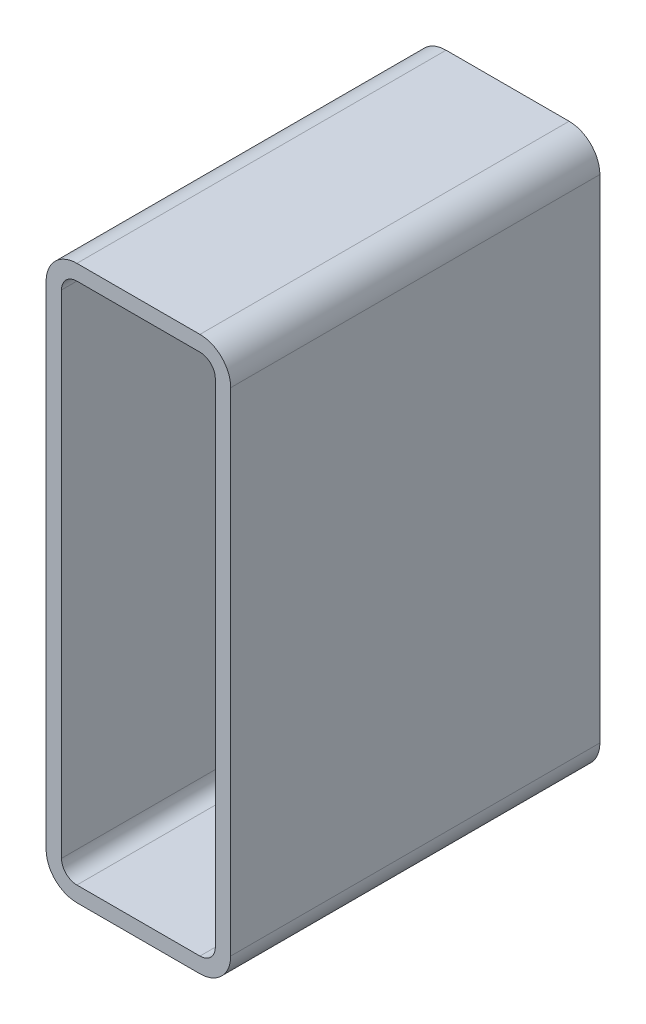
SolidWorks part; units mm, degrees
ref_plane "Front Plane" through (0, 0, 0) normal (0, 0, 1) x (1, 0, 0)
ref_plane "Top Plane" through (0, 0, 0) normal (0, 1, 0) x (1, 0, 0)
ref_plane "Right Plane" through (0, 0, 0) normal (1, 0, 0) x (0, 0, -1)
sketch "Sketch1" plane through (0, 0, 0) normal (0, 0, 1) x (1, 0, 0)
sketch_block_instance "HSS18x6x0.500-1"
sketch_block "HSS18x6x0.500"
extrude "Boss-Extrude1" add sketch "Sketch1" along normal blind 304.8
